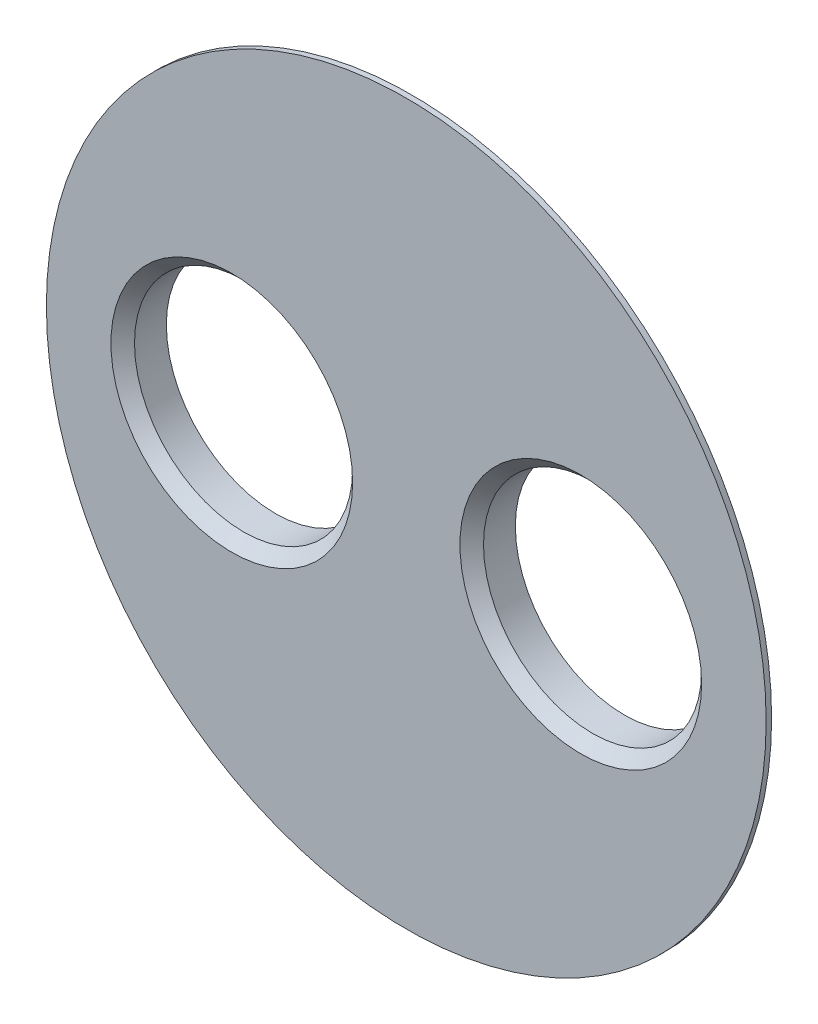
SolidWorks part; units mm, degrees
ref_plane "Plan de face" through (0, 0, 0) normal (0, 0, 1) x (1, 0, 0)
ref_plane "Plan de dessus" through (0, 0, 0) normal (0, 1, 0) x (1, 0, 0)
ref_plane "Plan de droite" through (0, 0, 0) normal (1, 0, 0) x (0, 0, -1)
sketch "Esquisse1" plane through (0, 0, 0) normal (0, 0, 1) x (1, 0, 0)
  circle A0 centre (0, 0) radius 82.5
  dimension "D1" = 165
extrude "Boss.-Extru.1" add sketch "Esquisse1" along normal blind 10
sketch "Esquisse2" plane through (0, 0, 10) normal (0, 0, 1) x (1, 0, 0)
  circle A0 centre (-40, 0) radius 25
  circle A1 centre (40, 0) radius 25
  dimension "D3" = 50
  dimension "D4" = 50
  dimension "D1" = 40
  dimension "D2" = 40
extrude "Enlèv. mat.-Extru.1" cut sketch "Esquisse2" against normal blind 10
chamfer "Chanfrein1" distance 2.7 angle 45 2 edges at (-15, 0, 10) (65, 0, 10)
chamfer "Chanfrein2" distance 12.5 angle 35 1 edges at (82.5, 0, 0)
